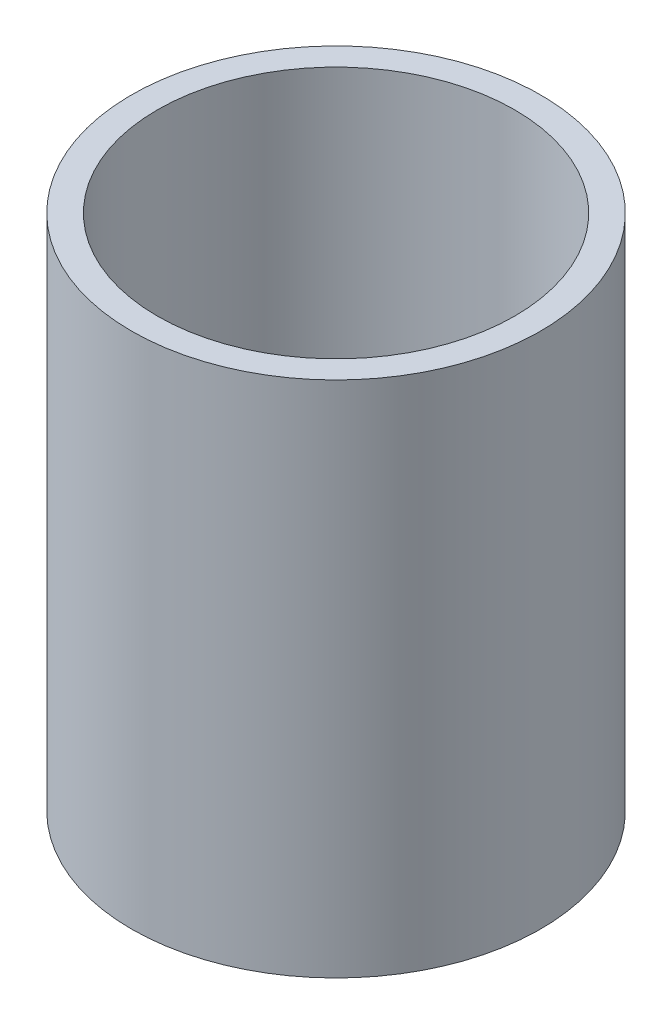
SolidWorks part; units mm, degrees
ref_plane "Front Plane" through (0, 0, 0) normal (0, 0, 1) x (1, 0, 0)
ref_plane "Top Plane" through (0, 0, 0) normal (0, 1, 0) x (1, 0, 0)
ref_plane "Right Plane" through (0, 0, 0) normal (1, 0, 0) x (0, 0, -1)
sketch "Sketch1" plane through (0, 0, 0) normal (0, 1, 0) x (1, 0, 0)
  circle A0 centre (0, 0) radius 10.033
  circle A1 centre (0, 0) radius 8.763
  dimension "D1" = 20.066
  dimension "D2" = 1.27
extrude "Boss-Extrude1" add sketch "Sketch1" along normal blind 25.4
